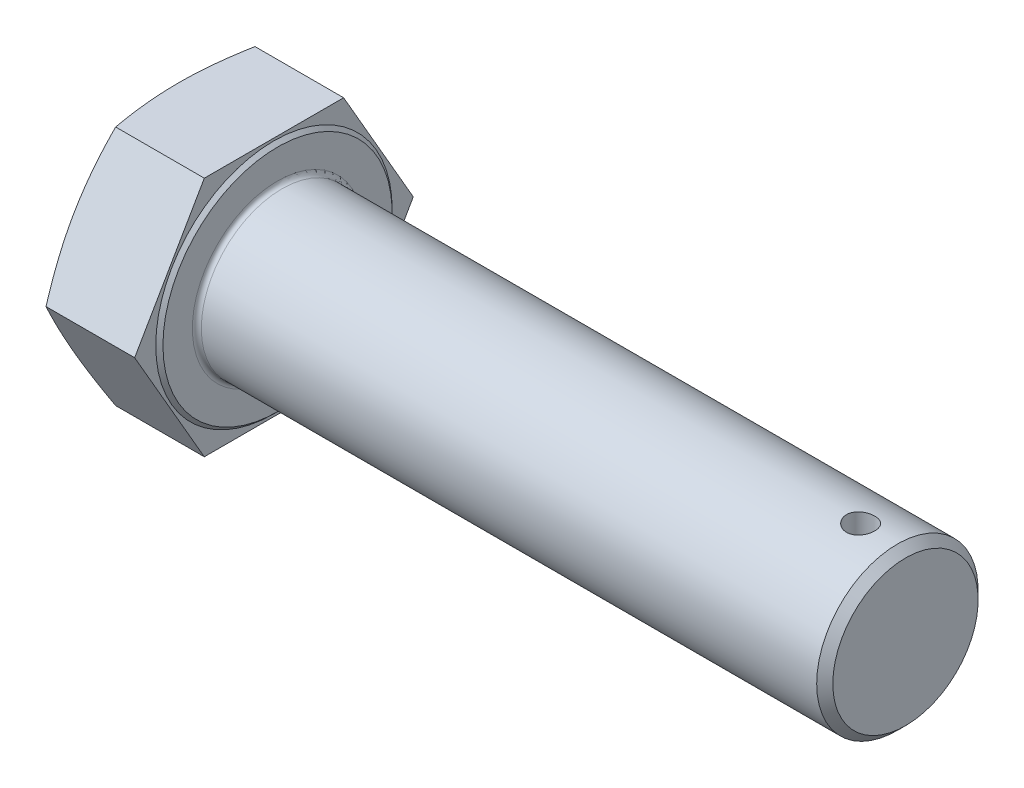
SolidWorks part; units mm, degrees
ref_plane "Front" through (0, 0, 0) normal (0, 0, 1) x (1, 0, 0)
ref_plane "Top" through (0, 0, 0) normal (0, 1, 0) x (1, 0, 0)
ref_plane "Right" through (0, 0, 0) normal (1, 0, 0) x (0, 0, -1)
sketch "Sketch2" plane through (0, 0, 0) normal (1, 0, 0) x (0, 0, -1)
  line L1 (31.0614, 0) -> (15.5307, 26.9)
  line L2 (15.5307, 26.9) -> (-15.5307, 26.9)
  line L3 (-15.5307, 26.9) -> (-31.0614, 0)
  line L4 (-31.0614, 0) -> (-15.5307, -26.9)
  line L5 (-15.5307, -26.9) -> (15.5307, -26.9)
  line L6 (15.5307, -26.9) -> (31.0614, 0)
  circle A0 centre (0, 0) radius 26.9 construction
  dimension "s" = 53.8
extrude "BaseHead" add sketch "Sketch2" along normal blind 22.08
sketch "Sketch3" plane through (0, 0, 0) normal (0, 1, 0) x (1, 0, 0)
  line L0 (22.08, 31.0614) -> (22.08, 25.555)
  line L2 (22.08, 25.555) -> (21.28, 26.355)
  line L3 (21.28, 26.355) -> (21.28, 31.0614)
  line L5 (21.28, 31.0614) -> (22.08, 31.0614)
  line L6 (-0.9571, 0) -> (7.6478, 0) construction
  line L9 (22.08, 31.0614) -> (0, 31.0614) construction
  dimension "D1" = 45
  dimension "c" = 0.8
  dimension "dw" = 51.11
revolve "BearingFace" cut sketch "Sketch3" angle 360 about L6
sketch "Sketch4" plane through (0, 0, 0) normal (0, 1, 0) x (1, 0, 0)
  line L0 (-0.4935, 0) -> (3.5626, 0) construction
  line L2 (0, 31.0614) -> (1.5146, 31.0614)
  line L4 (1.5146, 31.0614) -> (0, 26.9)
  line L6 (0, 26.9) -> (0, 31.0614)
  line L7 (21.28, 31.0614) -> (0, 31.0614) construction
  dimension "D1" = 20
  dimension "D2" = 53.8
revolve "HeadChamfer" cut sketch "Sketch4" angle 360 about L0
sketch "Sketch5" plane through (22.08, 0, 0) normal (1, 0, 0) x (0, 0, -1)
  circle A0 centre (0, 0) radius 18
  dimension "d" = 36
extrude "BaseBody" add sketch "Sketch5" along normal blind 140
chamfer "Chamfer1" distance 1.8 angle 45 1 edges at (162.08, 0, -18)
ref_plane "Plane1" through (78.08, 0, 0) normal (1, 0, 0) x (0, 0, -1)
sketch "Sketch6" plane through (0, 0, 0) normal (0, 1, 0) x (1, 0, 0)
  line L3 (22.08, -25.555) -> (22.08, 25.555) construction
  line L4 (160.28, 0) -> (22.08, 0) construction
  circle A0 centre (152.08, 0) radius 3.15
  dimension "d1" = 6.3
  dimension "lh" = 130
extrude "Hole" cut sketch "Sketch6" against normal through all and the other way through all
fillet "HeadFillet" radius 1 1 edges at (22.08, 0, -18)
equation "\"D2@Sketch4\" = \"s@Sketch2\""
equation "\"b@ThreadCosmetic1\" = \"l@BaseBody\" - \"lg@Plane1\""
equation "\"D1@Chamfer1\" = 0.05 * \"d@Sketch5\""
